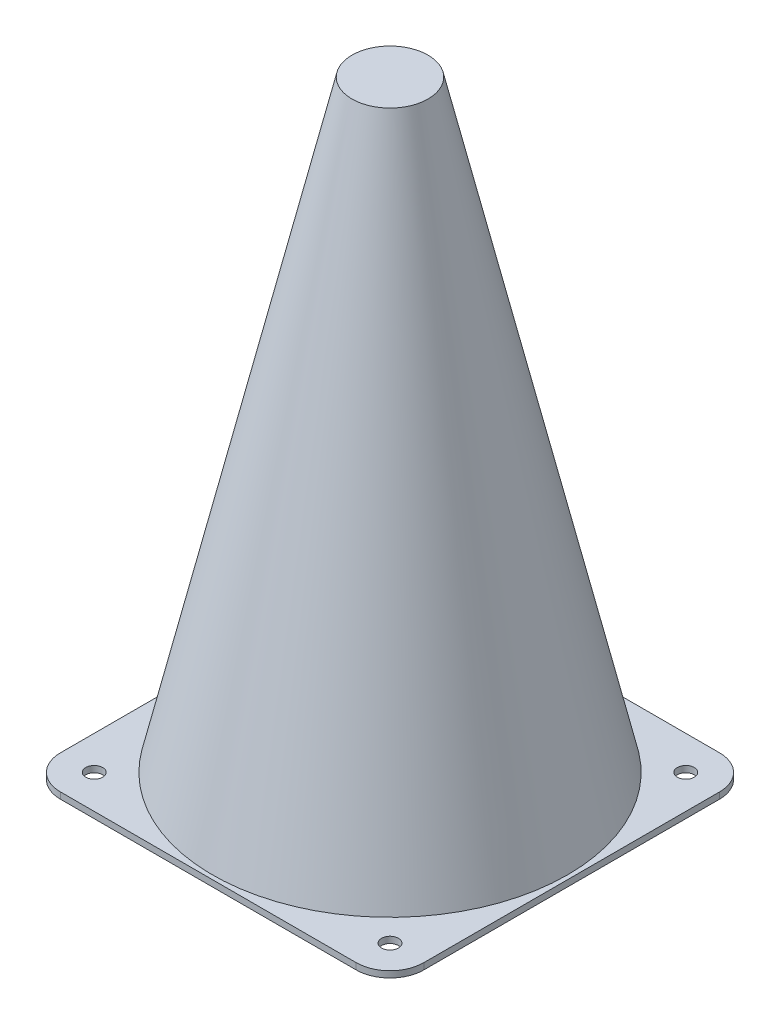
SolidWorks part; units mm, degrees
ref_plane "Front" through (0, 0, 0) normal (0, 0, 1) x (1, 0, 0)
ref_plane "Top" through (0, 0, 0) normal (0, 1, 0) x (1, 0, 0)
ref_plane "Right" through (0, 0, 0) normal (1, 0, 0) x (0, 0, -1)
sketch "Sketch1" plane through (0, 0, 0) normal (0, 1, 0) x (1, 0, 0)
  line L0 (-68.2625, 68.2625) -> (68.2625, -68.2625) construction
  line L1 (-55.5625, 68.2625) -> (55.5625, 68.2625)
  line L2 (-68.2625, 55.5625) -> (-68.2625, -55.5625)
  line L3 (-55.5625, -68.2625) -> (55.5625, -68.2625)
  line L4 (68.2625, 55.5625) -> (68.2625, -55.5625)
  line L5 (68.2625, 68.2625) -> (-68.2625, -68.2625) construction
  line L6 (55.5625, 55.5625) -> (-55.5625, 55.5625) construction
  line L7 (-55.5625, 55.5625) -> (-55.5625, -55.5625) construction
  line L8 (-55.5625, -55.5625) -> (55.5625, -55.5625) construction
  line L9 (55.5625, -55.5625) -> (55.5625, 55.5625) construction
  circle A0 centre (0, 0) radius 65.0875
  circle A1 centre (55.5625, 55.5625) radius 3.175
  circle A2 centre (-55.5625, 55.5625) radius 3.175
  circle A3 centre (-55.5625, -55.5625) radius 3.175
  circle A4 centre (55.5625, -55.5625) radius 3.175
  arc A5 (68.2625, 55.5625) -> (55.5625, 68.2625) centre (55.5625, 55.5625) ccw
  arc A6 (-55.5625, 68.2625) -> (-68.2625, 55.5625) centre (-55.5625, 55.5625) ccw
  arc A7 (-55.5625, -68.2625) -> (-68.2625, -55.5625) centre (-55.5625, -55.5625) cw
  arc A8 (68.2625, -55.5625) -> (55.5625, -68.2625) centre (55.5625, -55.5625) cw
  point P4 (0, 0)
  dimension "D1" = 130.175
  dimension "D3" = 6.35
  dimension "D5" = 12.7
  dimension "D2" = 136.525
  dimension "D4" = 12.7
extrude "Extrude1" add sketch "Sketch1" along normal blind 2.3813
sketch "Sketch3" plane through (0, 0, 0) normal (0, 0, 1) x (1, 0, 0)
  line L0 (14.2875, 228.6) -> (66.7171, 2.3813)
  line L1 (14.2875, 228.6) -> (0, 228.6)
  line L2 (0, 228.6) -> (0, 0) construction
  line L3 (0, 228.6) -> (0, 226.2188)
  line L4 (0, 226.2188) -> (13.2098, 226.2188)
  line L5 (13.2098, 226.2188) -> (65.0875, 2.3813)
  line L6 (-55.5625, 2.3813) -> (55.5625, 2.3813) construction
  line L7 (65.0875, 2.3813) -> (66.7171, 2.3813)
  line L8 (65.0875, 2.3813) -> (-65.0875, 2.3813) construction
  dimension "D1" = 2.3813
  dimension "D2" = 1.5875
  dimension "D3" = 14.2875
  dimension "D4" = 228.6
revolve "Revolve1" add sketch "Sketch3" angle 360 about L2
